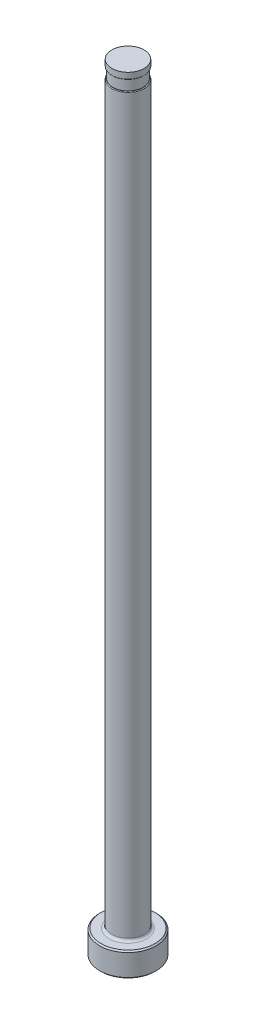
SolidWorks part; units mm, degrees
ref_plane "Front Plane" through (0, 0, 0) normal (0, 0, 1) x (1, 0, 0)
ref_plane "Top Plane" through (0, 0, 0) normal (0, 1, 0) x (1, 0, 0)
ref_plane "Right Plane" through (0, 0, 0) normal (1, 0, 0) x (0, 0, -1)
other "Configuration Table"
sketch "Sketch1" plane through (0, 0, 0) normal (0, 0, 1) x (1, 0, 0)
  line L0 (0, 259.9588) -> (0, -15.1925) construction
  line L1 (0, 0) -> (-5.5499, 0)
  line L2 (-5.5499, 0) -> (-5.5499, 4.7498)
  line L3 (-5.5499, 4.7498) -> (-3.175, 4.7498)
  line L4 (-3.175, 4.7498) -> (-3.175, 152.4)
  line L5 (-3.175, 152.4) -> (0, 152.4)
  line L6 (0, 152.4) -> (0, 0)
  dimension "L" = 152.4
  dimension "H" = 11.0998
  dimension "T" = 4.7498
  dimension "D" = 6.35
revolve "Revolve1" add sketch "Sketch1" angle 360 about L0
chamfer "Chamfer1" distance 0.254 angle 45 2 edges at (0, 4.7498, 5.5499) (0, 0, 5.5499)
fillet "Fillet1" radius 0.508 1 edges at (0, 4.7498, 3.175)
sketch "Sketch2" plane through (0, 0, 0) normal (0, 0, 1) x (1, 0, 0)
  line L0 (-3.175, 152.4) -> (-3.175, 5.2578) construction
  line L1 (-3.175, 151.13) -> (-2.9718, 151.13)
  line L2 (-3.175, 151.13) -> (-3.175, 149.098)
  line L3 (-3.175, 149.098) -> (-2.9718, 149.098)
  line L4 (-2.9718, 151.13) -> (-2.9718, 149.098)
  line L5 (3.175, 152.4) -> (-3.175, 152.4) construction
  line L6 (0, 153.4483) -> (0, 147.3282) construction
  dimension "D1" = 2.032
  dimension "N" = 1.27
  dimension "FD" = 0.2032
  dimension "D3" = 5.9436
revolve "Vent Relief" cut sketch "Sketch2" angle 360 about L6
sketch "Sketch3" plane through (0, 0, 0) normal (0, 0, 1) x (1, 0, 0)
  line L0 (-2.9718, 150.114) -> (-2.9718, 86.614)
  line L1 (-2.9718, 151.13) -> (-2.9718, 149.098) construction
  line L2 (-3.175, 149.098) -> (-3.175, 5.2578) construction
  line L3 (-3.175, 85.4964) -> (-3.175, 150.114)
  line L4 (-3.175, 150.114) -> (-2.9718, 150.114)
  arc A0 (-2.9718, 86.614) -> (-3.175, 85.4964) centre (-6.1468, 86.614) cw
  dimension "D1" = 3.175
  dimension "D2" = 63.5
extrude "D-Slot" cut sketch "Sketch3" against normal through all both and the other way through all
sketch "Sketch5" plane through (0, 0, 0) normal (0, 0, 1) x (1, 0, 0)
  line L0 (-3.175, 151.13) -> (3.175, 151.13) construction
  line L1 (-3.175, 152.4) -> (-3.1623, 152.4)
  line L2 (-3.175, 152.4) -> (-3.175, 151.13)
  line L3 (-3.175, 151.13) -> (-3.1623, 151.13)
  line L4 (-3.1623, 152.4) -> (-3.1623, 151.13)
  line L5 (0, 152.6877) -> (0, 150.5771) construction
  dimension "VP" = 0.0127
revolve "Vent Diameter" cut sketch "Sketch5" angle 360 about L5
fillet "Fillet2" radius 0.127 2 edges at (3.175, 149.098, 0) (0, 151.13, 3.1623)
sketch "Pocket Sketch" plane through (0, 0, 0) normal (0, 0, 1) x (1, 0, 0)
  line L0 (-5.9468, 0) -> (-5.9468, 4.7752)
  line L1 (-5.9468, 4.7752) -> (-4.1354, 4.7752)
  line L2 (-3.3734, 5.5372) -> (-3.3734, 22.225)
  line L3 (-3.3734, 22.225) -> (0, 22.225)
  line L4 (0, 22.225) -> (0, 0)
  line L5 (0, 0) -> (-5.9468, 0)
  line L6 (0, 12.6104) -> (0, -2.4989) construction
  line L7 (-5.5499, 4.4958) -> (-5.5499, 0.254) construction
  line L8 (5.2959, 4.7498) -> (-5.2959, 4.7498) construction
  line L9 (-3.175, 85.4964) -> (-3.175, 5.2578) construction
  line L10 (-4.1354, 4.7752) -> (-3.3734, 5.5372)
  point P3 (-3.3734, 4.7752)
  dimension "D1" = 11.8935
  dimension "D2" = 0.3969
  dimension "D3" = 0.0254
  dimension "D4" = 0.1984
  dimension "D5" = 6.7469
  dimension "D6" = 22.225
